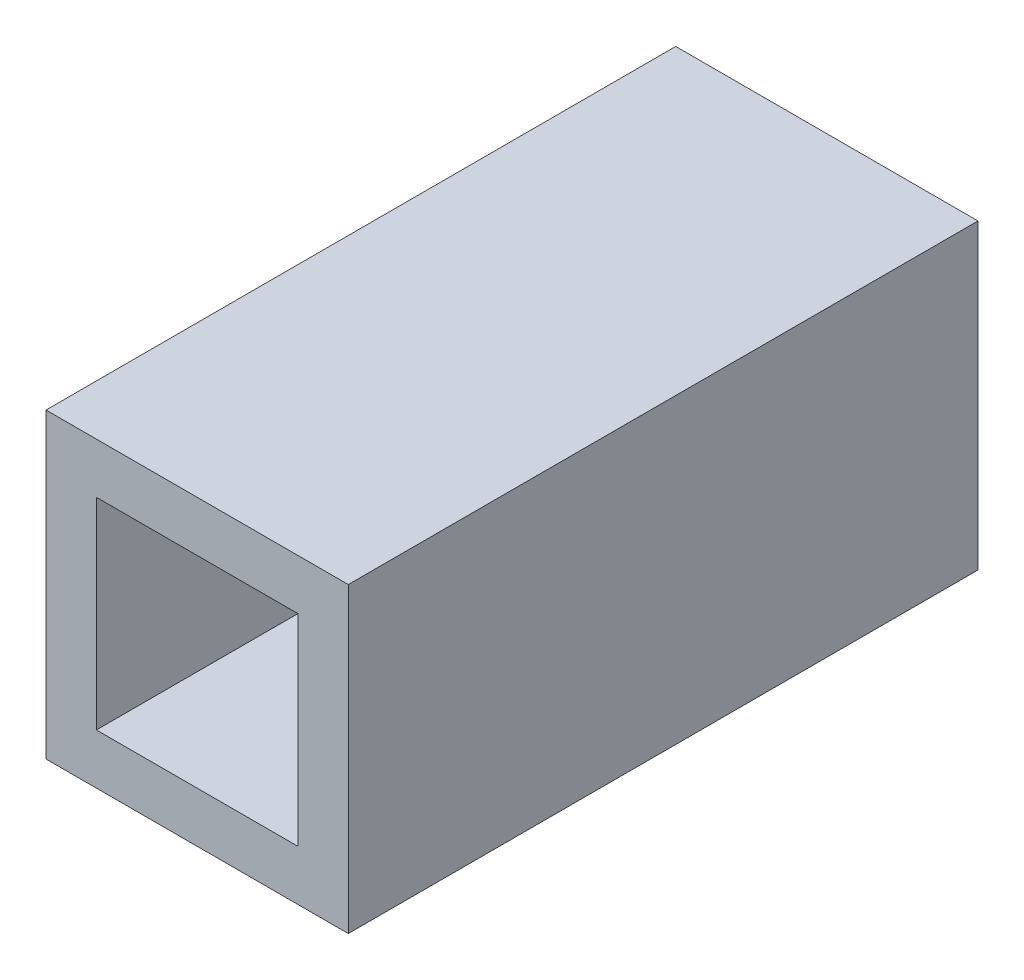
SolidWorks part; units mm, degrees
ref_plane "Front Plane" through (0, 0, 0) normal (0, 0, 1) x (1, 0, 0)
ref_plane "Top Plane" through (0, 0, 0) normal (0, 1, 0) x (1, 0, 0)
ref_plane "Right Plane" through (0, 0, 0) normal (1, 0, 0) x (0, 0, -1)
sketch "Sketch1" plane through (0, 0, 0) normal (0, 0, 1) x (1, 0, 0)
  line L1 (60, 60) -> (-60, 60)
  line L2 (60, 60) -> (60, -60)
  line L3 (60, -60) -> (-60, -60)
  line L4 (-60, 60) -> (-60, -60)
  line L5 (60, 60) -> (-60, -60) construction
  line L6 (60, -60) -> (-60, 60) construction
  point P0 (0, 0)
  dimension "D1" = 120
  dimension "D2" = 120
extrude "Boss-Extrude1" add sketch "Sketch1" along normal mid plane 250
sketch "Sketch2" plane through (0, 0, -125) normal (0, 0, -1) x (-1, 0, 0)
  line L8 (40, -40) -> (40, 40)
  line L9 (40, 40) -> (-40, 40)
  line L10 (-40, 40) -> (-40, -40)
  line L11 (-40, -40) -> (40, -40)
  line L12 (40, -40) -> (40, 40)
  line L13 (40, 40) -> (-40, 40)
  line L14 (-40, 40) -> (-40, -40)
  line L15 (-40, -40) -> (40, -40)
  dimension "D1" = 20
extrude "Cut-Extrude1" cut sketch "Sketch2" against normal through all
sketch "Sketch3" plane through (-60, 0, 0) normal (-1, 0, 0) x (0, 0, 1)
  line L1 (20, 10) -> (-20, 10)
  line L2 (20, 10) -> (20, -10)
  line L3 (20, -10) -> (-20, -10)
  line L4 (-20, 10) -> (-20, -10)
  line L5 (20, 10) -> (-20, -10) construction
  line L6 (20, -10) -> (-20, 10) construction
  point P0 (0, 0)
  dimension "D1" = 20
  dimension "D2" = 40
extrude "Cut-Extrude2" cut sketch "Sketch3" against normal blind 10
